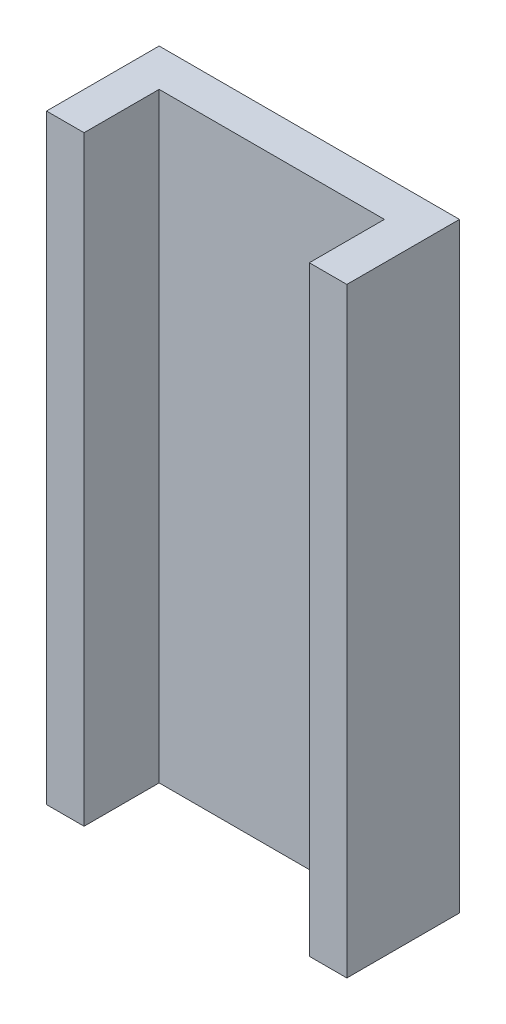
SolidWorks part; units mm, degrees
ref_plane "Front Plane" through (0, 0, 0) normal (0, 0, 1) x (1, 0, 0)
ref_plane "Top Plane" through (0, 0, 0) normal (0, 1, 0) x (1, 0, 0)
ref_plane "Right Plane" through (0, 0, 0) normal (1, 0, 0) x (0, 0, -1)
sketch "Sketch1" plane through (0, 0, 0) normal (0, 1, 0) x (1, 0, 0)
  line L0 (-19.05, 0) -> (19.05, 0)
  line L1 (19.05, 0) -> (19.05, -12.7)
  line L2 (19.05, -12.7) -> (25.4, -12.7)
  line L3 (25.4, -12.7) -> (25.4, 6.35)
  line L4 (25.4, 6.35) -> (-25.4, 6.35)
  line L5 (-25.4, 6.35) -> (-25.4, -12.7)
  line L6 (-25.4, -12.7) -> (-19.05, -12.7)
  line L7 (-19.05, -12.7) -> (-19.05, 0)
  line L8 (0, 6.35) -> (0, 0) construction
  point P11 (0, 0)
  dimension "D1" = 50.8
  dimension "D2" = 19.05
  dimension "D3" = 6.35
extrude "Boss-Extrude1" add sketch "Sketch1" along normal blind 101.6
